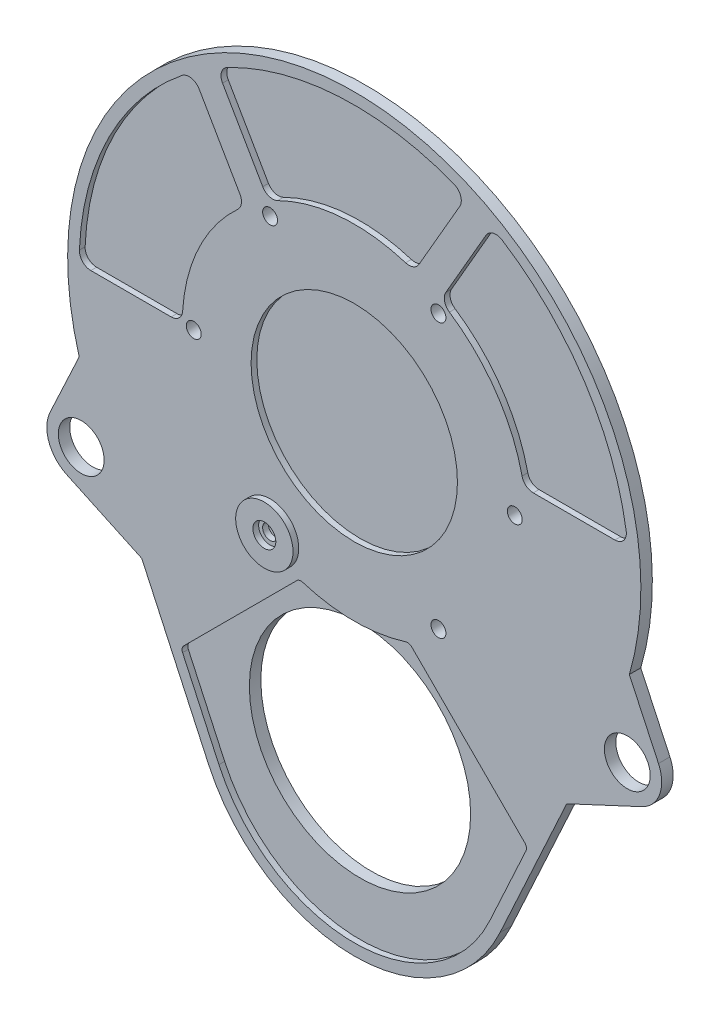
SolidWorks part; units mm, degrees
ref_plane "FACE" through (0, 0, 0) normal (0, 0, 1) x (1, 0, 0)
ref_plane "DESSUS" through (0, 0, 0) normal (0, 1, 0) x (1, 0, 0)
ref_plane "GAUCHE" through (0, 0, 0) normal (1, 0, 0) x (0, 0, -1)
sketch "Esquisse1" plane through (0, 0, 0) normal (0, 0, 1) x (1, 0, 0)
  line L0 (26.5346, -12.4821) -> (23.9916, -7.0287) construction
  line L1 (18.5332, -19.5234) -> (25.0836, -16.4689) construction
  line L2 (12.7166, -32.1555) -> (18.5332, -19.5234) construction
  line L3 (-18.5332, -19.5234) -> (-12.7166, -32.1555) construction
  line L4 (-25.0836, -16.4689) -> (-18.5332, -19.5234) construction
  line L5 (-23.9916, -7.0287) -> (-26.5346, -12.4821) construction
  line L6 (26.5346, -12.4821) -> (23.9916, -7.0287)
  line L7 (18.5332, -19.5234) -> (25.0836, -16.4689)
  line L8 (12.7166, -32.1555) -> (18.5332, -19.5234)
  line L9 (-18.5332, -19.5234) -> (-12.7166, -32.1555)
  line L10 (-25.0836, -16.4689) -> (-18.5332, -19.5234)
  line L11 (-23.9916, -7.0287) -> (-26.5346, -12.4821)
  line L12 (0, 0) -> (0, -42) construction
  arc A0 (25.0836, -16.4689) -> (26.5346, -12.4821) centre (23.8157, -13.75) ccw construction
  arc A1 (-12.7166, -32.1555) -> (12.7166, -32.1555) centre (0, -26.3) ccw construction
  arc A2 (-26.5346, -12.4821) -> (-25.0836, -16.4689) centre (-23.8157, -13.75) ccw construction
  arc A3 (23.9916, -7.0287) -> (-23.9916, -7.0287) centre (0, 0) ccw construction
  arc A4 (25.0836, -16.4689) -> (26.5346, -12.4821) centre (23.8157, -13.75) ccw
  arc A5 (-12.7166, -32.1555) -> (12.7166, -32.1555) centre (0, -26.3) ccw
  arc A6 (-26.5346, -12.4821) -> (-25.0836, -16.4689) centre (-23.8157, -13.75) ccw
  arc A7 (23.9916, -7.0287) -> (-23.9916, -7.0287) centre (0, 0) ccw
  circle A8 centre (23.8157, -13.75) radius 2 construction
  circle A9 centre (-23.8157, -13.75) radius 2 construction
  circle A10 centre (23.8157, -13.75) radius 2
  circle A11 centre (-23.8157, -13.75) radius 2
  circle A12 centre (0, -25) radius 9.65
  dimension "D1" = 19.3
  dimension "D2" = 25
extrude "Base-Extrusion" add sketch "Esquisse1" along normal blind 1
sketch "Esquisse2" plane through (0, 0, 1) normal (0, 0, 1) x (1, 0, 0)
  line L0 (-7.3426, -11.92) -> (8.5028, 13.8035) construction
  line L1 (7.3426, -11.92) -> (-8.4533, 13.7231) construction
  line L2 (-17, 0) -> (17, 0) construction
  circle A2 centre (-7.3426, -11.92) radius 0.65
  circle A3 centre (7.3426, -11.92) radius 0.65
  circle A4 centre (14, 0) radius 0.65
  circle A5 centre (-14, 0) radius 0.65
  circle A6 centre (7.3426, 11.92) radius 0.65
  circle A7 centre (-7.3426, 11.92) radius 0.65
  dimension "D3" = 1.3
  dimension "D4" = 1.3
  dimension "D5" = 1.3
  dimension "D6" = 1.3
  dimension "D7" = 1.3
  dimension "D8" = 1.3
extrude "Enlèv. mat.-Extru.1" cut sketch "Esquisse2" against normal through all
sketch "Esquisse3" plane through (0, 0, 1) normal (0, 0, 1) x (1, 0, 0)
  line L0 (-22.9783, 0) -> (-15.9687, 0)
  line L1 (0, 0) -> (-15.7003, 27.1937) construction
  line L2 (-13.5311, 18.4366) -> (-9.9713, 12.2708)
  arc A0 (-10.16, 11.0351) -> (-14.9707, 0.9375) centre (0, 0) ccw
  arc A1 (-15.0231, 18.7165) -> (-23.9773, 1.0435) centre (0, 0) ccw
  arc A2 (-22.9783, 0) -> (-23.9773, 1.0435) centre (-22.9783, 1) cw
  arc A3 (-14.9707, 0.9375) -> (-15.9687, 0) centre (-15.9687, 1) cw
  arc A4 (-9.9713, 12.2708) -> (-10.16, 11.0351) centre (-10.8373, 11.7708) cw
  arc A5 (-15.0231, 18.7165) -> (-13.5311, 18.4366) centre (-14.3972, 17.9366) cw
  dimension "D1" = 30
  dimension "D2" = 48
  dimension "D5" = 1
  dimension "D3" = 60
  dimension "D4" = 5
extrude "Enlèv. mat.-Extru.2" cut sketch "Esquisse3" against normal blind 0.5
pattern_circular "Répétition circulaire1" count 3 every 60
sketch "Esquisse4" plane through (0, 0, 1) normal (0, 0, 1) x (1, 0, 0)
  circle A0 centre (0, 0) radius 9
  dimension "D1" = 18
extrude "Enlèv. mat.-Extru.3" cut sketch "Esquisse4" against normal blind 0.5
sketch "Esquisse5" plane through (0, 0, 1) normal (0, 0, 1) x (1, 0, 0)
  line L0 (-5.0068, -14.4315) -> (-14.8739, -24.2985)
  line L1 (0, 0) -> (0, -42) construction
  line L2 (-14.9745, -24.8612) -> (-11.8083, -31.7373)
  line L3 (-18.5332, -19.5234) -> (-12.7166, -32.1555) construction
  line L4 (14.9745, -24.8612) -> (11.8083, -31.7373)
  line L5 (5.0068, -14.4315) -> (14.8739, -24.2985)
  arc A0 (-11.8083, -31.7373) -> (11.8083, -31.7373) centre (0, -26.3) ccw
  arc A1 (-12.7166, -32.1555) -> (12.7166, -32.1555) centre (0, -26.3) ccw construction
  arc A2 (-4.5032, -14.3081) -> (4.5032, -14.3081) centre (0, 0) ccw
  arc A3 (14.6367, 3.2813) -> (8.2972, 12.4962) centre (0, 0) ccw construction
  arc A4 (-14.9745, -24.8612) -> (-14.8739, -24.2985) centre (-14.5203, -24.6521) cw
  arc A5 (14.8739, -24.2985) -> (14.9745, -24.8612) centre (14.5203, -24.6521) cw
  arc A7 (5.0068, -14.4315) -> (4.5032, -14.3081) centre (4.6533, -14.785) ccw
  arc A8 (-5.0068, -14.4315) -> (-4.5032, -14.3081) centre (-4.6533, -14.785) cw
  circle A9 centre (0, -25) radius 9.65 construction
  circle A10 centre (0, -25) radius 9.65
  point P24 (4.79, -14.2146)
  point P30 (-4.79, -14.2146)
  dimension "D1" = 26
  dimension "D3" = 0.5
  dimension "D2" = 45
extrude "Enlèv. mat.-Extru.4" cut sketch "Esquisse5" against normal blind 0.5
sketch "Esquisse6" plane through (0, 0, 1) normal (0, 0, 1) x (1, 0, 0)
  circle A0 centre (-7.3426, -11.92) radius 2.5
  circle A1 centre (-7.3426, -11.92) radius 0.65 construction
  circle A2 centre (-7.3426, -11.92) radius 1
  dimension "D1" = 5
  dimension "D2" = 2
extrude "Boss.-Extru.1" add sketch "Esquisse6" along normal blind 0.5
sketch "Esquisse7" plane through (0, 0, 0) normal (0, 0, -1) x (-1, 0, 0)
  line L0 (22.9783, 0) -> (15.9687, 0) construction
  line L1 (9.9713, 12.2708) -> (13.5311, 18.4366) construction
  line L2 (22.9783, 0) -> (15.9687, 0)
  line L3 (9.9713, 12.2708) -> (13.5311, 18.4366)
  arc A0 (22.9783, 0) -> (23.9773, 1.0435) centre (22.9783, 1) ccw construction
  arc A1 (14.9707, 0.9375) -> (15.9687, 0) centre (15.9687, 1) ccw construction
  arc A2 (14.9707, 0.9375) -> (10.16, 11.0351) centre (0, 0) ccw construction
  arc A3 (9.9713, 12.2708) -> (10.16, 11.0351) centre (10.8373, 11.7708) ccw construction
  arc A4 (15.0231, 18.7165) -> (13.5311, 18.4366) centre (14.3972, 17.9366) ccw construction
  arc A5 (23.9773, 1.0435) -> (15.0231, 18.7165) centre (0, 0) ccw construction
  arc A6 (22.9783, 0) -> (23.9773, 1.0435) centre (22.9783, 1) ccw
  arc A7 (14.9707, 0.9375) -> (15.9687, 0) centre (15.9687, 1) ccw
  arc A8 (14.9707, 0.9375) -> (10.16, 11.0351) centre (0, 0) ccw
  arc A9 (9.9713, 12.2708) -> (10.16, 11.0351) centre (10.8373, 11.7708) ccw
  arc A10 (15.0231, 18.7165) -> (13.5311, 18.4366) centre (14.3972, 17.9366) ccw
  arc A11 (23.9773, 1.0435) -> (15.0231, 18.7165) centre (0, 0) ccw
extrude "Boss.-Extru.2" add sketch "Esquisse7" along normal blind 0.5
pattern_circular "Répétition circulaire2" count 3 every 60
sketch "Esquisse8" plane through (0, 0, 0) normal (0, 0, -1) x (-1, 0, 0)
  circle A0 centre (0, 0) radius 9 construction
  circle A1 centre (0, 0) radius 9
extrude "Boss.-Extru.3" add sketch "Esquisse8" along normal blind 0.5
sketch "Esquisse9" plane through (0, 0, 0) normal (0, 0, -1) x (-1, 0, 0)
  line L0 (14.9745, -24.8612) -> (11.8083, -31.7373) construction
  line L1 (5.0068, -14.4315) -> (14.8739, -24.2985) construction
  line L2 (-11.8083, -31.7373) -> (-14.9745, -24.8612) construction
  line L3 (-14.8739, -24.2985) -> (-5.0068, -14.4315) construction
  line L4 (14.9745, -24.8612) -> (11.8083, -31.7373)
  line L5 (5.0068, -14.4315) -> (14.8739, -24.2985)
  line L6 (-11.8083, -31.7373) -> (-14.9745, -24.8612)
  line L7 (-14.8739, -24.2985) -> (-5.0068, -14.4315)
  circle A0 centre (0, -25) radius 9.65 construction
  circle A1 centre (0, -25) radius 9.65
  arc A2 (14.9745, -24.8612) -> (14.8739, -24.2985) centre (14.5203, -24.6521) ccw construction
  arc A3 (-11.8083, -31.7373) -> (11.8083, -31.7373) centre (0, -26.3) ccw construction
  arc A4 (-14.8739, -24.2985) -> (-14.9745, -24.8612) centre (-14.5203, -24.6521) ccw construction
  arc A5 (-4.5032, -14.3081) -> (-5.0068, -14.4315) centre (-4.6533, -14.785) ccw construction
  arc A6 (-4.5032, -14.3081) -> (4.5032, -14.3081) centre (0, 0) ccw construction
  arc A7 (5.0068, -14.4315) -> (4.5032, -14.3081) centre (4.6533, -14.785) ccw construction
  arc A8 (14.9745, -24.8612) -> (14.8739, -24.2985) centre (14.5203, -24.6521) ccw
  arc A9 (-11.8083, -31.7373) -> (11.8083, -31.7373) centre (0, -26.3) ccw
  arc A10 (-14.8739, -24.2985) -> (-14.9745, -24.8612) centre (-14.5203, -24.6521) ccw
  arc A11 (-4.5032, -14.3081) -> (-5.0068, -14.4315) centre (-4.6533, -14.785) ccw
  arc A12 (-4.5032, -14.3081) -> (4.5032, -14.3081) centre (0, 0) ccw
  arc A13 (5.0068, -14.4315) -> (4.5032, -14.3081) centre (4.6533, -14.785) ccw
extrude "Boss.-Extru.4" add sketch "Esquisse9" along normal blind 0.5
sketch "Esquisse10" plane through (0, 0, 0) normal (0, 0, -1) x (-1, 0, 0)
  circle A0 centre (7.3426, -11.92) radius 2.3
  circle A1 centre (7.3426, -11.92) radius 2.5 construction
  circle A2 centre (7.3426, -11.92) radius 1.25
  dimension "D1" = 4.6
  dimension "D2" = 2.5
extrude "Enlèv. mat.-Extru.5" cut sketch "Esquisse10" against normal blind 0.5
sketch "Esquisse11" plane through (0, 0, 0) normal (0, 0, -1) x (-1, 0, 0)
  circle A0 centre (7.3426, -11.92) radius 0.65 construction
  circle A1 centre (7.3426, -11.92) radius 0.65
extrude "Boss.-Extru.5" add sketch "Esquisse11" against normal blind 0.5
